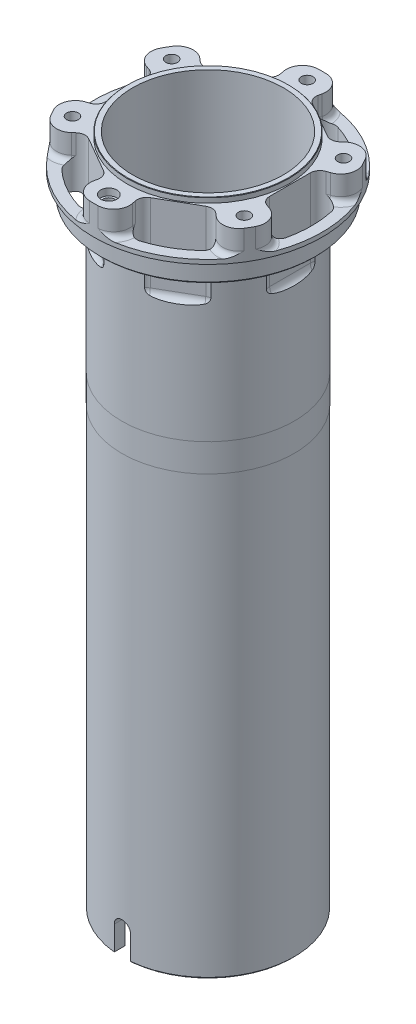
SolidWorks part; units mm, degrees
ref_plane "Front Plane" through (0, 0, 0) normal (0, 0, 1) x (1, 0, 0)
ref_plane "Top Plane" through (0, 0, 0) normal (0, 1, 0) x (1, 0, 0)
ref_plane "Right Plane" through (0, 0, 0) normal (1, 0, 0) x (0, 0, -1)
sketch "Sketch1" plane through (0, 0, 0) normal (0, 0, 1) x (1, 0, 0)
  line L0 (0, 0) -> (0, 40.0271) construction
  line L1 (-23.8125, 0) -> (-33.655, 0)
  line L2 (-31.7373, -8.636) -> (-33.655, -8.636)
  line L3 (-23.8125, 0) -> (-23.8125, 1.524)
  line L4 (-33.655, 0) -> (-33.655, -5)
  line L5 (-23.8125, 1.524) -> (-22.225, 1.524)
  line L6 (-22.225, 1.524) -> (-22.225, 0)
  line L7 (-22.225, 0) -> (-22.225, -196.85)
  line L8 (-22.225, -196.85) -> (-25.3365, -196.85)
  line L9 (-33.655, -5) -> (-37.592, -5) construction
  line L10 (-37.592, -5) -> (-37.592, -7.032) construction
  line L11 (-37.592, -7.032) -> (-33.655, -7.032) construction
  line L12 (-33.655, -7.032) -> (-33.655, -8.636)
  line L13 (-33.655, -5) -> (-33.655, -7.032)
  line L14 (-25.4, -59.69) -> (-25.3746, -59.69)
  line L15 (-25.3746, -59.69) -> (-25.3746, -67.945)
  line L16 (-25.3746, -67.945) -> (-25.3365, -67.945)
  line L17 (-31.7373, -14.986) -> (-25.4, -14.986)
  line L18 (0, 0) -> (-22.225, 0) construction
  line L19 (-25.3365, -196.85) -> (-25.3365, -67.945)
  line L20 (-31.7373, -8.636) -> (-31.7373, -14.986)
  line L21 (-25.4, -59.69) -> (-25.4, -14.986)
  dimension "D2" = 47.625
  dimension "D3" = 44.45
  dimension "D4" = 6.35
  dimension "D5" = 14.986
  dimension "D6" = 5
  dimension "D7" = 2.032
  dimension "D8" = 37.592
  dimension "D9" = 1.524
  dimension "D10" = 67.31
  dimension "D11" = 50.673
  dimension "D12" = 196.85
  dimension "D13" = 8.255
  dimension "D14" = 63.4746
  dimension "D15" = 50.7492
  dimension "D16" = 59.69
  dimension "D17" = 50.8
revolve "Revolve1" add sketch "Sketch1" angle 360 about L0
hole_wizard "#8-32 Tapped Hole1" positions "Sketch8" profile "Sketch7" tap size "#8-32" standard "ANSI Inch"
sketch "Sketch8" plane through (0, 0, 0) normal (0, 1, 0) x (1, 0, 0)
  line L0 (0, -28.575) -> (0, 0) construction
  point P0 (0, -28.575)
  dimension "D1" = 28.575
sketch "Sketch7" plane through (0, 0, 28.575) normal (1, 0, 0) x (0, 0, 1)
  line L0 (0, 0) -> (0, 12.446)
  line L1 (0, 12.446) -> (1.7272, 12.446)
  line L2 (1.7272, 12.446) -> (1.7272, 0)
  line L5 (1.7272, 0) -> (0, 0)
  line L10 (0, 12.446) -> (-1.7272, 12.446) construction
  line L11 (0, -6.35) -> (0, 107.95) construction
  dimension "Tap Drill Dia." = 3.4544
  dimension "Tap Drill Depth" = 12.446
  dimension "Drill Angle" = 180
hole_wizard "#8-32 Tapped Hole2" positions "Sketch10" profile "Sketch9" tap size "#8-32" standard "ANSI Inch"
sketch "Sketch10" plane through (0, 0, 0) normal (0, 1, 0) x (1, 0, 0)
  line L0 (0, -39.37) -> (0, 0) construction
  line L1 (0, 0) -> (25.2966, -14.605) construction
  point P0 (25.2966, -14.605)
  dimension "D1" = 29.21
  dimension "D2" = 60
sketch "Sketch9" plane through (25.2966, 0, 14.605) normal (1, 0, 0) x (0, 0, 1)
  line L0 (0, 0) -> (0, 196.85)
  line L1 (0, 196.85) -> (1.7272, 196.85)
  line L2 (1.7272, 196.85) -> (1.7272, 0)
  line L5 (1.7272, 0) -> (0, 0)
  line L11 (0, -6.35) -> (0, 107.95) construction
  dimension "Thru Tap Drill Dia." = 3.4544
  dimension "Thru Tap Drill Depth" = 196.85
fillet "Fillet1" radius 1.5875 1 edges at (0, -14.986, -25.4)
sketch "Sketch11" plane through (0, 0, 0) normal (0, 1, 0) x (1, 0, 0)
  line L0 (18.6682, -20.3728) -> (0, 0) construction
  line L1 (0, 0) -> (8.3093, -26.3536) construction
  line L2 (0, 0) -> (0, -42.7723) construction
  line L3 (0, 0) -> (25.2966, -14.605) construction
  line L4 (0, -27.6325) -> (23.9304, -13.8163) construction
  line L5 (15.24, -26.3965) -> (11.9652, -20.7244) construction
  line L6 (0, 0) -> (20.2848, -18.0003) construction
  line L7 (0, 0) -> (5.3952, -26.318) construction
  line L8 (17.5063, -18.1298) -> (6.9477, -24.2258) construction
  line L9 (6.9477, -24.2258) -> (9.6528, -28.9111) construction
  line L10 (9.6528, -28.9111) -> (20.2114, -22.8151) construction
  line L11 (20.2114, -22.8151) -> (17.5063, -18.1298) construction
  line L12 (17.2445, -17.9068) -> (6.8855, -23.8876)
  arc A0 (20.592, -22.4722) -> (17.2445, -17.9068) centre (18.6682, -20.3728) ccw
  arc A1 (9.1655, -29.0693) -> (20.592, -22.4722) centre (0, 0) ccw
  circle A2 centre (0, 0) radius 27.6325 construction
  arc A3 (6.8855, -23.8876) -> (9.1655, -29.0693) centre (8.3093, -26.3536) ccw
  dimension "D1" = 24.13
  dimension "D2" = 30.48
  dimension "D3" = 5.4102
  dimension "D4" = 25
  dimension "D5" = 12.192
extrude "Cut-Extrude1" cut sketch "Sketch11" against normal blind 25.4
sketch "Sketch12" plane through (0, 0, 0) normal (0, 1, 0) x (1, 0, 0)
  line L0 (21.3151, -18.9146) -> (24.4761, -15.3524) construction
  line L1 (0, 0) -> (15.24, -26.3965) construction
  line L2 (5.723, -27.9167) -> (1.0575, -28.8731) construction
  line L3 (5.5198, -26.9254) -> (5.723, -27.9167)
  line L4 (20.5582, -18.243) -> (21.3151, -18.9146)
  line L5 (5.5198, -26.9254) -> (20.5582, -18.243)
  line L6 (5.5198, -26.9254) -> (0, 0) construction
  line L7 (0, 0) -> (20.5582, -18.243) construction
  arc A0 (21.3151, -18.9146) -> (28.5106, -17.883) centre (24.4761, -15.3524) ccw
  circle A1 centre (0, 0) radius 33.655 construction
  arc A3 (1.2318, -33.6324) -> (28.5106, -17.883) centre (0, 0) ccw
  arc A4 (9.1655, -29.0693) -> (20.592, -22.4722) centre (0, 0) ccw construction
  arc A5 (5.723, -27.9167) -> (1.2318, -33.6324) centre (1.0575, -28.8731) cw
  arc A7 (6.8855, -23.8876) -> (9.1655, -29.0693) centre (8.3093, -26.3536) ccw construction
  arc A8 (20.592, -22.4722) -> (17.2445, -17.9068) centre (18.6682, -20.3728) ccw construction
  dimension "D1" = 4.7625
extrude "Cut-Extrude2" cut sketch "Sketch12" against normal blind 7.366
fillet "Fillet3" radius 2.3813 2 edges at (17.7883, -25.4, 17.6647) (6.4039, -25.4, 24.2375)
fillet "Fillet2" radius 1.5875 4 edges at (25.152, -7.366, 20.0667) (4.8023, -7.366, 31.8156) (20.9367, -7.366, 18.5788) (5.6214, -7.366, 27.4211)
pattern_circular "CirPattern1" count 6 over 360 about axis through (0, 0, 0) along (0, 1, 0) of "#8-32 Tapped Hole2"
pattern_circular "CirPattern2" count 6 over 360 of "Cut-Extrude1", "Cut-Extrude2", "Fillet2", "Fillet3"
sketch "Sketch13" plane through (0, 0, 0) normal (0, 1, 0) x (1, 0, 0)
  circle A0 centre (0, -29.21) radius 2.3813
  dimension "D1" = 4.7625
extrude "Cut-Extrude3" cut sketch "Sketch13" against normal blind 2.032
sketch "Sketch14" plane through (0, 0, 0) normal (0, 0, 1) x (1, 0, 0)
  line L0 (0, 0) -> (0, -215.7438) construction
  line L1 (2.3813, -189.23) -> (2.3813, -196.85)
  line L2 (2.3813, -196.85) -> (-2.3813, -196.85)
  line L3 (-2.3813, -196.85) -> (-2.3813, -189.23)
  line L4 (-22.225, -196.85) -> (22.225, -196.85) construction
  arc A0 (2.3813, -189.23) -> (-2.3813, -189.23) centre (0, -189.23) ccw
  dimension "D1" = 4.7625
  dimension "D2" = 7.62
extrude "Cut-Extrude4" cut sketch "Sketch14" along normal through all
chamfer "Chamfer1" distance 0.508 angle 45 4 edges at (0, -14.986, -31.7373) (0, -196.85, -25.3365) (-2.3813, -196.85, 23.6607) (2.3813, -196.85, 23.6607)
sketch "Sketch15" plane through (0, -196.85, 0) normal (0, -1, 0) x (1, 0, 0)
  circle A0 centre (0, 0) radius 41.6284
extrude "Cut-Extrude5" [suppressed] cut sketch "Sketch15" against normal offset from surface (165.1 mm away) 31.75
sketch "Sketch16" [suppressed] plane through (0, -31.75, 0) normal (0, -1, 0) x (1, 0, 0)
  circle A0 centre (0, 0) radius 20.6375
  circle A1 centre (0, 0) radius 22.86
  circle A2 centre (0, 0) radius 22.86 construction
  dimension "D1" = 41.275
extrude "Boss-Extrude1" [suppressed] add sketch "Sketch16" against normal through all
chamfer "Chamfer2" distance 0.127 angle 45 1 edges at (0, 1.524, -23.8125)
sketch "Sketch17" plane through (0, -196.85, 0) normal (0, -1, 0) x (1, 0, 0)
  line L0 (0, 0) -> (0, 25.273) construction
  line L1 (0, 25.273) -> (1.4021, 27.7016)
  line L2 (1.4021, 27.7016) -> (-1.4021, 27.7016)
  line L3 (-1.4021, 27.7016) -> (0, 25.273)
  line L4 (0, 25.273) -> (0, 27.7016) construction
  dimension "D1" = 60
  dimension "D2" = 25.273
extrude "Cut-Extrude6" cut sketch "Sketch17" against normal blind 114.3
